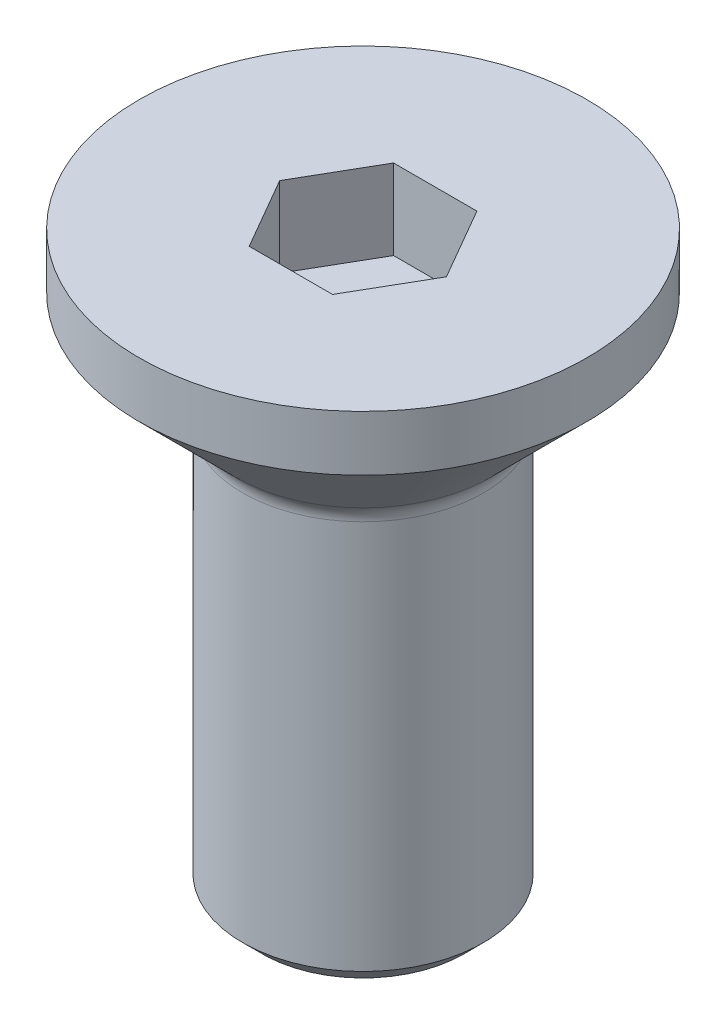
SolidWorks part; units mm, degrees
ref_plane "Plan1" through (0, 0, 0) normal (0, 0, 1) x (1, 0, 0)
ref_plane "Plan2" through (0, 0, 0) normal (0, 1, 0) x (1, 0, 0)
ref_plane "Plan3" through (0, 0, 0) normal (1, 0, 0) x (0, 0, -1)
sketch "Esquisse1" plane through (0, 0, 0) normal (0, 0, 1) x (1, 0, 0)
  line L0 (0, 0) -> (0, -12) construction
  line L1 (4.65, -1.15) -> (2.6464, -3.1536)
  line L2 (4.65, -1.15) -> (4.65, 0)
  line L3 (4.65, 0) -> (0, 0)
  line L4 (2.5, -3.5071) -> (2.5, -11.6)
  line L5 (2.1, -12) -> (0, -12)
  line L6 (2.5, -11.6) -> (2.1, -12)
  line L7 (0, 0) -> (0, -12)
  line L8 (2.6464, -3.1536) -> (2.5, -3.3) construction
  line L9 (2.5, -3.5071) -> (2.5, -3.3) construction
  arc A0 (2.6464, -3.1536) -> (2.5, -3.5071) centre (3, -3.5071) ccw
  point P12 (2.5, -12)
  dimension "C" = 0.5
  dimension "D1" = 9.3
  dimension "R" = 0.4
  dimension "D2" = 45
  dimension "D4" = 45
  dimension "L1" = 12
  dimension "H" = 3.3
  dimension "D" = 5
  dimension "H1" = 1.15
revolve "Révolution1" add sketch "Esquisse1" angle 360 about L0
sketch "Esquisse2" plane through (0, 0, 0) normal (0, 1, 0) x (1, 0, 0)
  line L1 (1.7321, 0) -> (0.866, 1.5)
  line L2 (0.866, 1.5) -> (-0.866, 1.5)
  line L3 (-0.866, 1.5) -> (-1.7321, 0)
  line L4 (-1.7321, 0) -> (-0.866, -1.5)
  line L5 (-0.866, -1.5) -> (0.866, -1.5)
  line L6 (0.866, -1.5) -> (1.7321, 0)
  circle A0 centre (0, 0) radius 1.5 construction
  dimension "S" = 3
extrude "Enlèv. mat.-Extru.1" cut sketch "Esquisse2" against normal blind 1.6667
equation "\"R@Esquisse1\"=(\"D@Esquisse1\"-\"D2@Représentation de filetage1\")/2"
equation "\"C@Esquisse1\"=\"D@Esquisse1\"/10"
equation "\"Prof@Enlèv. mat.-Extru.1\"=\"D@Esquisse1\"/3"
